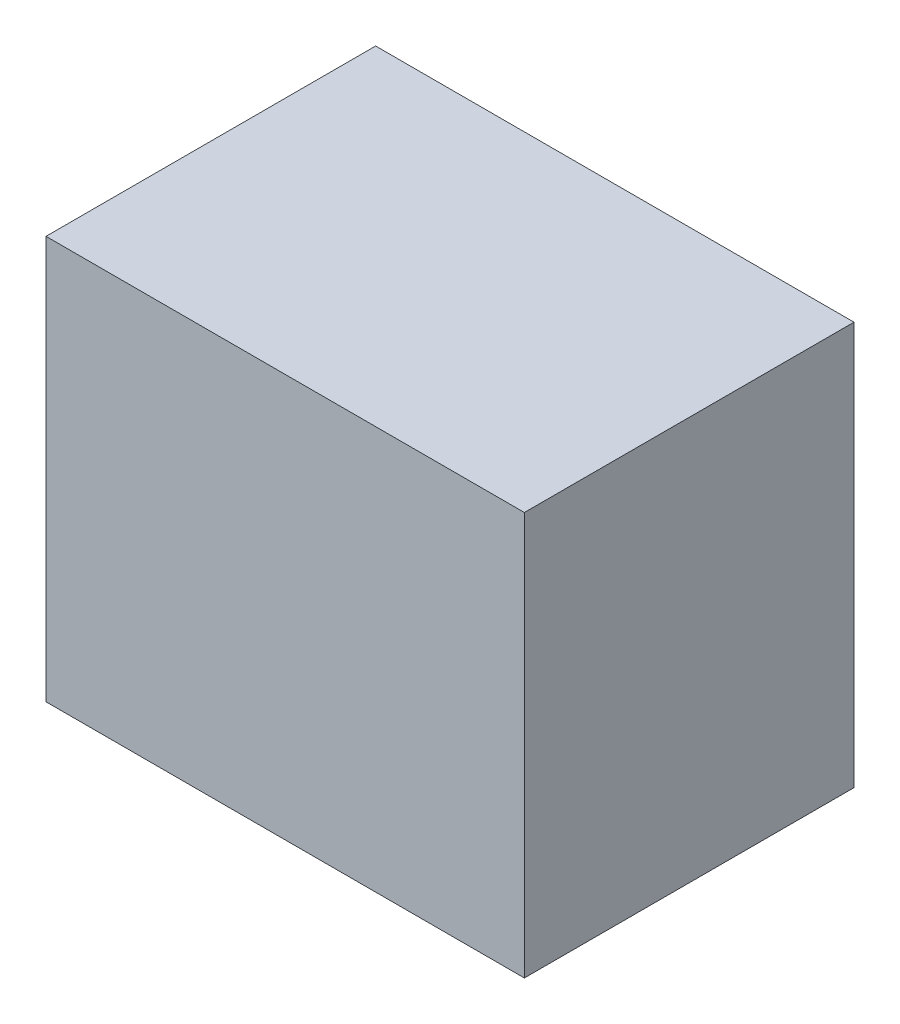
SolidWorks part; units mm, degrees
ref_plane "Front Plane" through (0, 0, 0) normal (0, 0, 1) x (1, 0, 0)
ref_plane "Top Plane" through (0, 0, 0) normal (0, 1, 0) x (1, 0, 0)
ref_plane "Right Plane" through (0, 0, 0) normal (1, 0, 0) x (0, 0, -1)
sketch "Sketch1" plane through (0, 0, 0) normal (0, 0, 1) x (1, 0, 0)
  line L1 (0, 0) -> (73.7197, 0)
  line L2 (0, 0) -> (0, 62.1285)
  line L3 (0, 62.1285) -> (73.7197, 62.1285)
  line L4 (73.7197, 0) -> (73.7197, 62.1285)
extrude "Boss-Extrude1" add sketch "Sketch1" along normal blind 50.8
